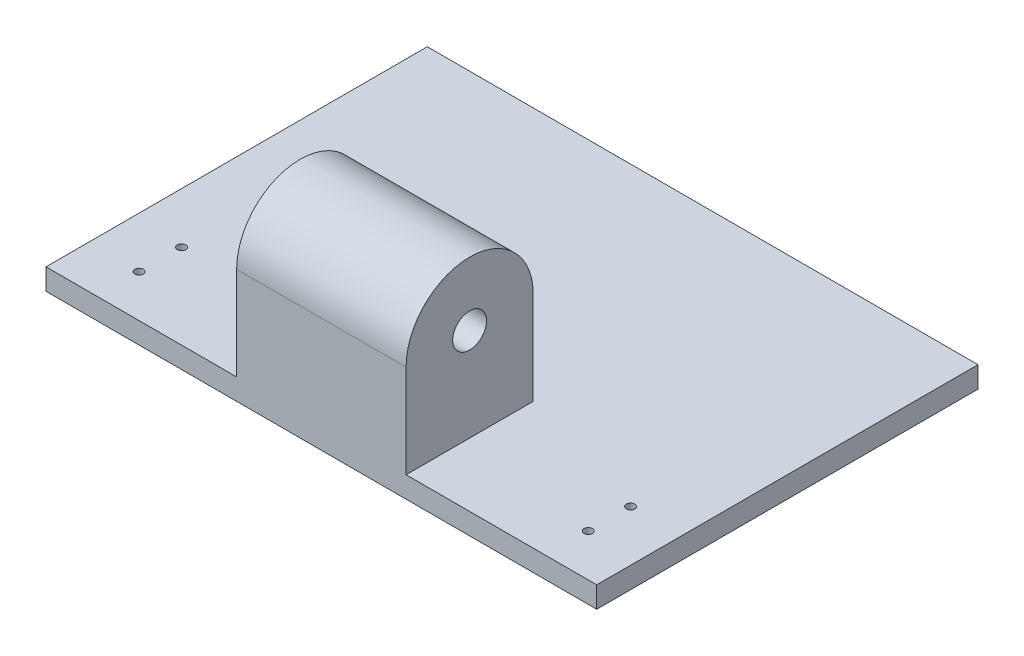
SolidWorks part; units mm, degrees
ref_plane "前视基准面" through (0, 0, 0) normal (0, 0, 1) x (1, 0, 0)
ref_plane "上视基准面" through (0, 0, 0) normal (0, 1, 0) x (1, 0, 0)
ref_plane "右视基准面" through (0, 0, 0) normal (1, 0, 0) x (0, 0, -1)
sketch "草图1" plane through (0, 0, 0) normal (1, 0, 0) x (0, 0, -1)
  line L1 (-15, 0) -> (15, 0)
  line L2 (-15, 0) -> (-15, -22)
  line L3 (-15, -22) -> (15, -22)
  line L4 (15, 0) -> (15, -22)
  circle A0 centre (0, 0) radius 4
  circle A1 centre (0, 0) radius 15
  dimension "D1" = 8
  dimension "D2" = 30
  dimension "D3" = 30
  dimension "D4" = 22
extrude "凸台-拉伸1" add sketch "草图1" along normal blind 40 contours L1 A1 A0 | L1 A1 A0 | A1 L2 L3 L4
sketch "草图3" plane through (0, -22, 0) normal (0, -1, 0) x (1, 0, 0)
  line L0 (40, -15) -> (0, -15) construction
  line L1 (85, -15) -> (-45, -15)
  line L2 (85, -15) -> (85, 15)
  line L3 (85, 15) -> (-45, 15)
  line L4 (-45, -15) -> (-45, 15)
  line L6 (40, 15) -> (40, -15) construction
  dimension "D1" = 0
  dimension "D2" = 30
  dimension "D3" = 130
  dimension "D4" = 45
extrude "凸台-拉伸2" add sketch "草图3" along normal blind 5
sketch "草图4" plane through (0, -27, 0) normal (0, -1, 0) x (1, 0, 0)
  line L0 (-45, -15) -> (85, -15) construction
  line L2 (85, -15) -> (85, 15) construction
  circle A0 centre (73, 5) radius 1
  circle A1 centre (73, -5) radius 1
  circle A2 centre (-33.0224, 5) radius 1
  circle A3 centre (-33, -5) radius 1
  dimension "D2" = 10
  dimension "D3" = 10
  dimension "D4" = 0
  dimension "D5" = 2
  dimension "D6" = 2
  dimension "D7" = 2
  dimension "D8" = 2
  dimension "D1" = 106
  dimension "D9" = 10
  dimension "D10" = 12
  dimension "D11" = 10
extrude "切除-拉伸2" cut sketch "草图4" against normal up to next
sketch "草图5" plane through (0, 0, -15) normal (0, 0, -1) x (-1, 0, 0)
  line L1 (-85, -27) -> (45, -27)
  line L2 (-85, -27) -> (-85, -22)
  line L3 (-85, -22) -> (45, -22)
  line L4 (45, -27) -> (45, -22)
extrude "凸台-拉伸3" add sketch "草图5" along normal blind 60
